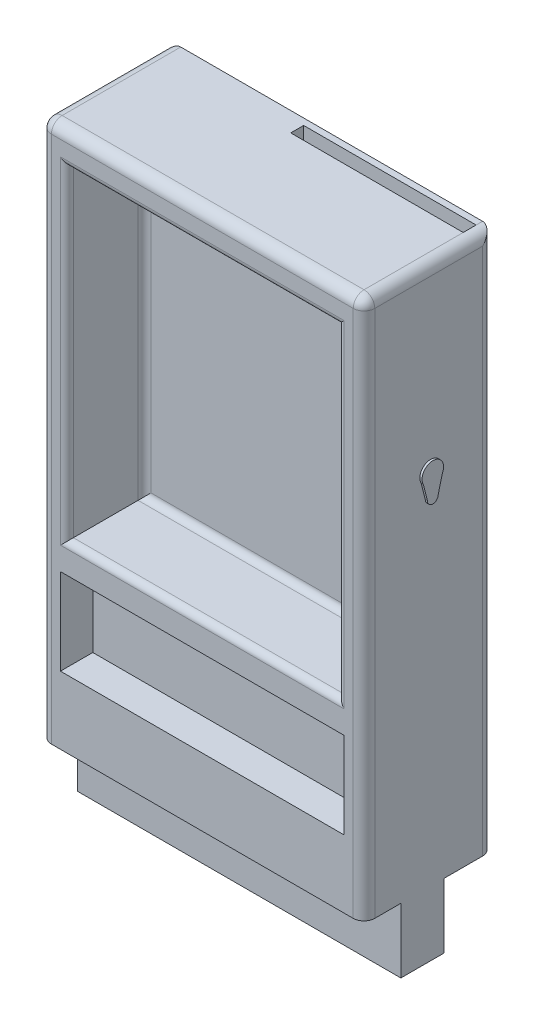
SolidWorks part; units mm, degrees
ref_plane "Front Plane" through (0, 0, 0) normal (0, 0, 1) x (1, 0, 0)
ref_plane "Top Plane" through (0, 0, 0) normal (0, 1, 0) x (1, 0, 0)
ref_plane "Right Plane" through (0, 0, 0) normal (1, 0, 0) x (0, 0, -1)
sketch "Sketch2" plane through (0, 0, 0) normal (0, 0, 1) x (1, 0, 0)
  line L1 (0, 0) -> (381, 0)
  line L2 (0, 0) -> (0, 635)
  line L3 (0, 635) -> (381, 635)
  line L4 (381, 0) -> (381, 635)
  dimension "D1" = 635
  dimension "D2" = 381
extrude "Boss-Extrude1" add sketch "Sketch2" along normal blind 152.4
sketch "Sketch3" plane through (0, 635, 0) normal (0, 1, 0) x (1, 0, 0)
  line L0 (381, -152.4) -> (381, 0) construction
  line L1 (368.3, -22.86) -> (165.1, -22.86)
  line L2 (368.3, -22.86) -> (368.3, -7.62)
  line L3 (368.3, -7.62) -> (165.1, -7.62)
  line L4 (165.1, -22.86) -> (165.1, -7.62)
  line L5 (381, 0) -> (0, 0) construction
  dimension "D1" = 12.7
  dimension "D2" = 7.62
  dimension "D3" = 203.2
  dimension "D4" = 15.24
extrude "Cut-Extrude1" cut sketch "Sketch3" against normal blind 381
sketch "Sketch4" plane through (0, 0, 152.4) normal (0, 0, 1) x (1, 0, 0)
  line L1 (31.0134, 596.9) -> (350.012, 596.9)
  line L2 (31.0134, 596.9) -> (31.0134, 215.9)
  line L3 (31.0134, 215.9) -> (350.012, 215.9)
  line L4 (350.012, 596.9) -> (350.012, 215.9)
  line L5 (381, 0) -> (381, 635) construction
  line L8 (381, 635) -> (0, 635) construction
  point P10 (190.5, 635)
  dimension "D1" = 381
  dimension "D2" = 30.988
  dimension "D3" = 38.1
extrude "Cut-Extrude2" cut sketch "Sketch4" against normal offset from surface (91.44 mm away) 60.96
fillet "Fillet1" radius 12.7 7 edges at (0, 317.5, 0) (0, 635, 76.2) (381, 317.5, 0) (381, 635, 76.2) (190.5, 635, 152.4) (381, 317.5, 152.4) (0, 317.5, 152.4)
fillet "Fillet2" radius 7.62 8 edges at (190.5127, 596.9, 152.4) (350.012, 406.4, 152.4) (190.5127, 215.9, 152.4) (31.0134, 406.4, 152.4) (190.5127, 215.9, 60.96) (350.012, 406.4, 60.96) (190.5127, 596.9, 60.96) (31.0134, 406.4, 60.96)
sketch "Sketch5" plane through (0, 0, 152.4) normal (0, 0, 1) x (1, 0, 0)
  line L0 (23.3934, 181.3466) -> (357.632, 181.3466)
  line L1 (357.632, 181.3466) -> (357.632, 79.7466)
  line L2 (357.632, 79.7466) -> (23.3934, 79.7466)
  line L3 (23.3934, 79.7466) -> (23.3934, 181.3466)
  dimension "D1" = 101.6
extrude "Cut-Extrude3" cut sketch "Sketch5" against normal blind 38.1
sketch "Sketch6" plane through (0, 0, 0) normal (0, -1, 0) x (1, 0, 0)
  line L0 (0, 139.7) -> (0, 12.7) construction
  line L1 (0, 108.9925) -> (381, 108.9925)
  line L2 (0, 108.9925) -> (0, 58.1925)
  line L3 (0, 58.1925) -> (381, 58.1925)
  line L4 (381, 108.9925) -> (381, 58.1925)
  line L5 (381, 139.7) -> (381, 12.7) construction
  dimension "D1" = 50.8
extrude "Boss-Extrude2" add sketch "Sketch6" along normal blind 76.2
sketch "Sketch7" plane through (381, 0, 0) normal (1, 0, 0) x (0, 0, -1)
  line L0 (-85.0612, 416.6117) -> (-80.2343, 397.5004)
  line L1 (-62.7074, 416.6117) -> (-67.5343, 397.5004)
  arc A0 (-62.7074, 416.6117) -> (-85.0612, 416.6117) centre (-73.8843, 422.6422) ccw
  arc A1 (-80.2343, 397.5004) -> (-67.5343, 397.5004) centre (-73.8843, 397.5004) ccw
extrude "Boss-Extrude3" add sketch "Sketch7" along normal blind 2.54
